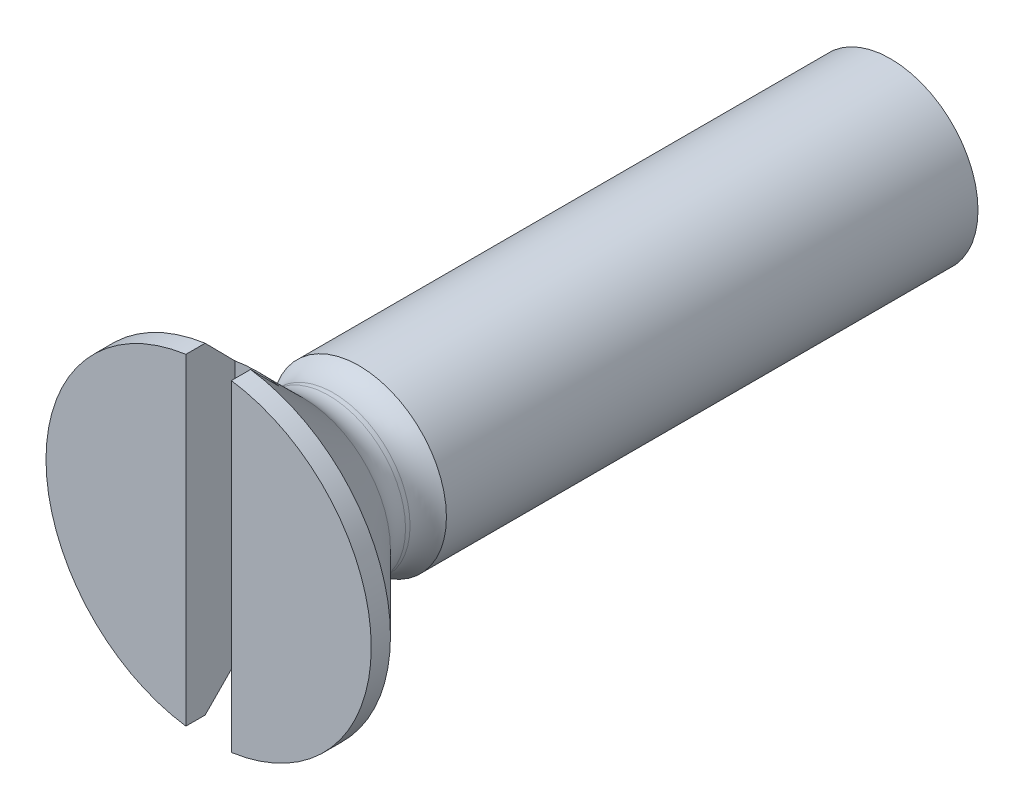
SolidWorks part; units mm, degrees
ref_plane "face" through (0, 0, 0) normal (0, 0, 1) x (1, 0, 0)
ref_plane "dessus" through (0, 0, 0) normal (0, 1, 0) x (1, 0, 0)
ref_plane "profil" through (0, 0, 0) normal (1, 0, 0) x (0, 0, -1)
imported_body "Importée1"
sketch "Esquisse3" plane through (0, 0, 0) normal (1, 0, 0) x (0, 0, -1)
  line L0 (20, 0) -> (20, 2)
  line L1 (0.55, 0) -> (0, 0) construction
  line L2 (20, 2) -> (19.5, 2.5)
  line L4 (19.5, 2.5) -> (19.5, 0)
  line L5 (19.5, 0) -> (20, 0)
  line L6 (18.7587, 0) -> (20.9263, 0) construction
  dimension "D1" = 135
revolve "Chanfrein debut filetage" cut sketch "Esquisse3" angle 360 about L6
